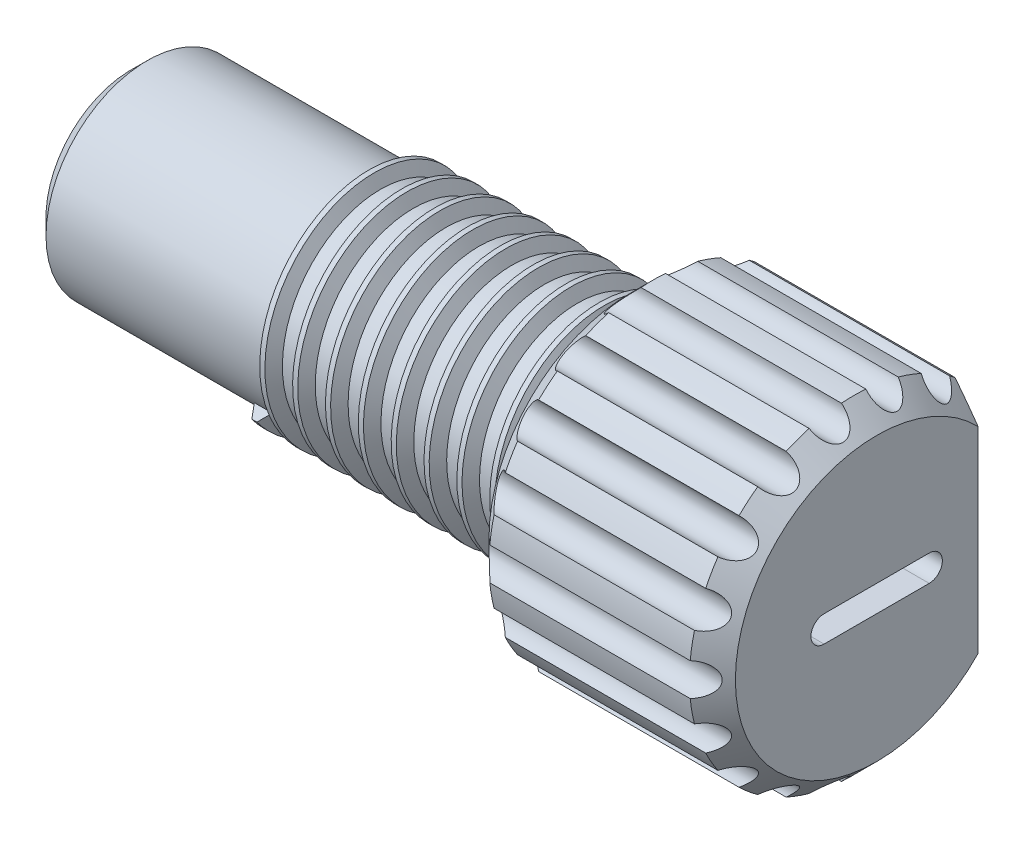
SolidWorks part; units mm, degrees
ref_plane "Front Plane" through (0, 0, 0) normal (0, 0, 1) x (1, 0, 0)
ref_plane "Top Plane" through (0, 0, 0) normal (0, 1, 0) x (1, 0, 0)
ref_plane "Right Plane" through (0, 0, 0) normal (1, 0, 0) x (0, 0, -1)
sketch "Sketch1" plane through (0, 0, 0) normal (0, 1, 0) x (1, 0, 0)
  circle A0 centre (0, 0) radius 3.9179
  circle A1 centre (0, 0) radius 4.0005 construction
  dimension "D1" = 7.8359
  dimension "D2" = 8.001
extrude "Boss-Extrude1" add sketch "Sketch1" along normal blind 19.304
sketch "Sketch2" plane through (0, 19.304, 0) normal (0, 1, 0) x (1, 0, 0)
  line L0 (0, 0) -> (16.129, 0) construction
  circle A0 centre (16.129, 0) radius 3.9179 construction
  circle A1 centre (0, 0) radius 3.9179 construction
  circle A2 centre (0, 0) radius 8.0645 construction
  circle A3 centre (16.129, 0) radius 8.0645 construction
  circle A4 centre (0, 0) radius 6.35
  dimension "D2" = 12.7
  dimension "D1" = 16.129
extrude "Boss-Extrude2" add sketch "Sketch2" along normal blind 9.525
sketch "Sketch4" plane through (0, 28.829, 0) normal (0, 1, 0) x (1, 0, 0)
  line L0 (0, -2.032) -> (0, 2.032) construction
  line L1 (-0.508, -2.032) -> (-0.508, 2.032)
  line L2 (0.508, -2.032) -> (0.508, 2.032)
  arc A0 (-0.508, -2.032) -> (0.508, -2.032) centre (0, -2.032) ccw
  arc A1 (0.508, 2.032) -> (-0.508, 2.032) centre (0, 2.032) ccw
  point P3 (0, 0)
  dimension "D1" = 4.064
  dimension "D2" = 1.016
extrude "Cut-Extrude2" cut sketch "Sketch4" against normal blind 3.81
thread "Thread1" pitch 0.7937 start angle 270, offset 0, length 10.668, pitch 1.27, diameter 7.8359
ref_plane "Plane1" through (0, 19.304, 3.9179) normal (-1, 0, 0) x (0, 0, -1)
sketch "Thread Profile1" plane through (0, 19.304, 3.9179) normal (-1, 0, 0) x (0, 0, -1)
  line L0 (0, 0) -> (0, 0.7937) construction
  line L11 (0, 0) -> (0, 0.6945)
  line L12 (0, 0.6945) -> (-0.4296, 0.4465)
  line L13 (-0.4296, 0.4465) -> (-0.4296, 0.248)
  line L15 (-0.4296, 0.248) -> (0, 0)
  line L17 (-0.4296, 0.3473) -> (0, 0.3473) construction
  point P2 (0, 0)
  dimension "Pitch" = 0.7937
  dimension "Profile_Angle" = 60
  dimension "Profile_Land" = 0.1984
  dimension "Profile_Height" = 0.4296
sketch "Sketch8" plane through (0, 0, 0) normal (0, -1, 0) x (1, 0, 0)
  line L0 (6.35, 3.9179) -> (-6.35, 3.9179)
  circle A4 centre (0, 0) radius 3.918 construction
  circle A5 centre (0, 0) radius 3.9179 construction
  arc A6 (6.35, 3.9179) -> (-6.35, 3.9179) centre (0, 3.9179) ccw
  circle A7 centre (0, 0) radius 6.35 construction
  point P3 (0, 3.9179)
  dimension "D1" = 12.7
extrude "Cut-Extrude3" cut sketch "Sketch8" against normal through all
chamfer "Chamfer1" distance 0.889 angle 45 2 edges at (0, 19.304, -6.35) (0, 28.829, -6.35)
sketch "Sketch3" plane through (0, 28.829, 0) normal (0, 1, 0) x (1, 0, 0)
  line L0 (0, 0) -> (0, 6.35) construction
  circle A0 centre (0, 6.35) radius 0.635
  circle A1 centre (0, 0) radius 6.35 construction
  circle A2 centre (2.1718, 5.967) radius 0.635
  circle A3 centre (4.0817, 4.8644) radius 0.635
  circle A4 centre (5.4993, 3.175) radius 0.635
  circle A5 centre (6.2535, 1.1027) radius 0.635
  circle A6 centre (6.2535, -1.1027) radius 0.635
  circle A7 centre (5.4993, -3.175) radius 0.635
  circle A8 centre (4.0817, -4.8644) radius 0.635
  circle A9 centre (2.1718, -5.967) radius 0.635
  circle A10 centre (0, -6.35) radius 0.635
  circle A11 centre (-2.1718, -5.967) radius 0.635
  circle A12 centre (-4.0817, -4.8644) radius 0.635
  circle A13 centre (-5.4993, -3.175) radius 0.635
  circle A14 centre (-6.2535, -1.1027) radius 0.635
  circle A15 centre (-6.2535, 1.1027) radius 0.635
  circle A16 centre (-5.4993, 3.175) radius 0.635
  circle A17 centre (-4.0817, 4.8644) radius 0.635
  circle A18 centre (-2.1718, 5.967) radius 0.635
  point P43 (0, 0)
  dimension "D1" = 1.27
  dimension "D2" = 18
extrude "Cut-Extrude1" cut sketch "Sketch3" against normal up to surface (9.525 mm away)
chamfer "Chamfer2" distance 0.635 angle 45 1 edges at (0, 0, 3.9179)
move or copy body "Body-Move/Copy1" bodies to move or copy 103 copy no rotation origin (-7.2073, 7.2073, -1.0214) rotation axis (0.7071, 0.7071, 0) rotation angle 180
